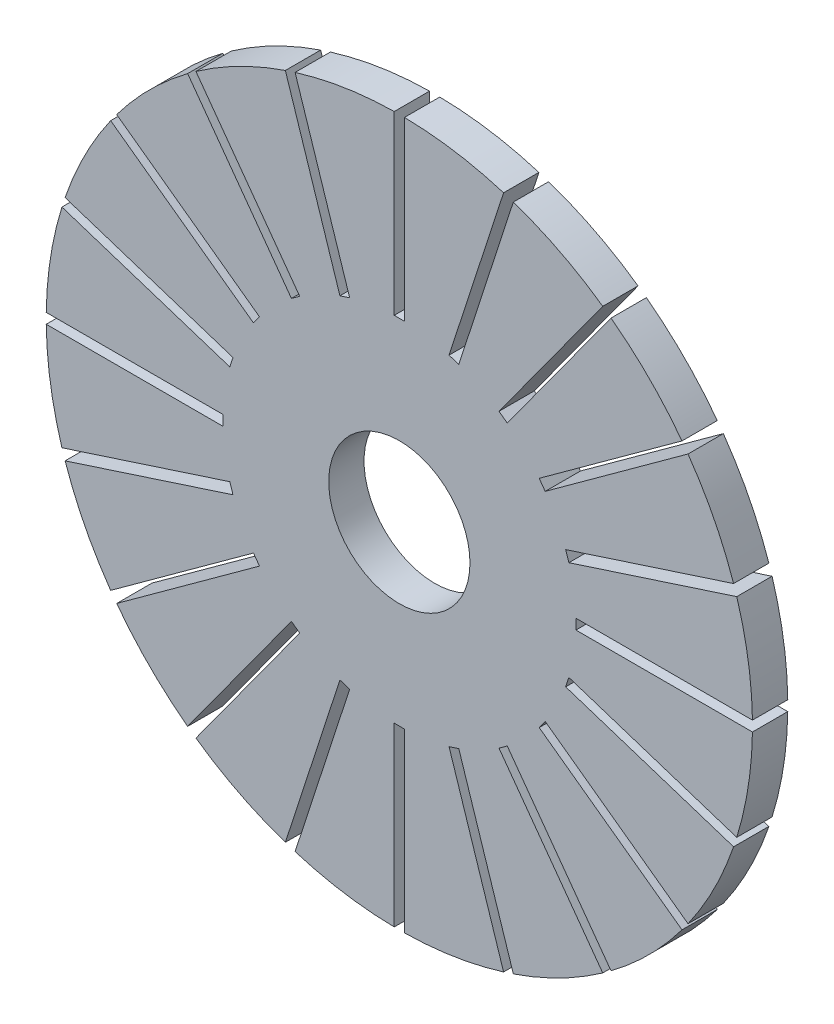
SolidWorks part; units mm, degrees
ref_plane "Front Plane" through (0, 0, 0) normal (0, 0, 1) x (1, 0, 0)
ref_plane "Top Plane" through (0, 0, 0) normal (0, 1, 0) x (1, 0, 0)
ref_plane "Right Plane" through (0, 0, 0) normal (1, 0, 0) x (0, 0, -1)
sketch "Sketch2" plane through (0, 0, 0) normal (0, 0, 1) x (1, 0, 0)
  line L0 (0, 134.1412) -> (0, -136.8693) construction
  line L1 (-158.1514, 0) -> (192.9154, 0) construction
  line L2 (16.8299, 47.1048) -> (14.0718, 48.0009)
  line L3 (1.45, 50) -> (-1.45, 50)
  line L4 (1.45, 50) -> (1.45, 100)
  line L5 (16.8299, 47.1048) -> (32.2807, 94.6576)
  line L6 (-1.45, 50) -> (-1.45, 100)
  line L7 (1.45, 50) -> (-1.45, 100) construction
  line L8 (1.45, 100) -> (-1.45, 50) construction
  line L9 (14.0718, 48.0009) -> (29.5227, 95.5537)
  line L10 (16.8299, 47.1048) -> (29.5227, 95.5537) construction
  line L11 (32.2807, 94.6576) -> (14.0718, 48.0009) construction
  line L12 (30.5623, 39.5986) -> (28.2162, 41.3031)
  line L13 (30.5623, 39.5986) -> (59.9516, 80.0494)
  line L14 (28.2162, 41.3031) -> (57.6055, 81.754)
  line L15 (30.5623, 39.5986) -> (57.6055, 81.754) construction
  line L16 (59.9516, 80.0494) -> (28.2162, 41.3031) construction
  line L17 (41.3031, 28.2162) -> (39.5986, 30.5623)
  line L18 (41.3031, 28.2162) -> (81.754, 57.6055)
  line L19 (39.5986, 30.5623) -> (80.0494, 59.9516)
  line L20 (41.3031, 28.2162) -> (80.0494, 59.9516) construction
  line L21 (81.754, 57.6055) -> (39.5986, 30.5623) construction
  line L22 (48.0009, 14.0718) -> (47.1048, 16.8299)
  line L23 (48.0009, 14.0718) -> (95.5537, 29.5227)
  line L24 (47.1048, 16.8299) -> (94.6576, 32.2807)
  line L25 (48.0009, 14.0718) -> (94.6576, 32.2807) construction
  line L26 (95.5537, 29.5227) -> (47.1048, 16.8299) construction
  line L27 (50, -1.45) -> (50, 1.45)
  line L28 (50, -1.45) -> (100, -1.45)
  line L29 (50, 1.45) -> (100, 1.45)
  line L30 (50, -1.45) -> (100, 1.45) construction
  line L31 (100, -1.45) -> (50, 1.45) construction
  line L32 (47.1048, -16.8299) -> (48.0009, -14.0718)
  line L33 (47.1048, -16.8299) -> (94.6576, -32.2807)
  line L34 (48.0009, -14.0718) -> (95.5537, -29.5227)
  line L35 (47.1048, -16.8299) -> (95.5537, -29.5227) construction
  line L36 (94.6576, -32.2807) -> (48.0009, -14.0718) construction
  line L37 (39.5986, -30.5623) -> (41.3031, -28.2162)
  line L38 (39.5986, -30.5623) -> (80.0494, -59.9516)
  line L39 (41.3031, -28.2162) -> (81.754, -57.6055)
  line L40 (39.5986, -30.5623) -> (81.754, -57.6055) construction
  line L41 (80.0494, -59.9516) -> (41.3031, -28.2162) construction
  line L42 (28.2162, -41.3031) -> (30.5623, -39.5986)
  line L43 (28.2162, -41.3031) -> (57.6055, -81.754)
  line L44 (30.5623, -39.5986) -> (59.9516, -80.0494)
  line L45 (28.2162, -41.3031) -> (59.9516, -80.0494) construction
  line L46 (57.6055, -81.754) -> (30.5623, -39.5986) construction
  line L47 (14.0718, -48.0009) -> (16.8299, -47.1048)
  line L48 (14.0718, -48.0009) -> (29.5227, -95.5537)
  line L49 (16.8299, -47.1048) -> (32.2807, -94.6576)
  line L50 (14.0718, -48.0009) -> (32.2807, -94.6576) construction
  line L51 (29.5227, -95.5537) -> (16.8299, -47.1048) construction
  line L52 (-1.45, -50) -> (1.45, -50)
  line L53 (-1.45, -50) -> (-1.45, -100)
  line L54 (1.45, -50) -> (1.45, -100)
  line L55 (-1.45, -50) -> (1.45, -100) construction
  line L56 (-1.45, -100) -> (1.45, -50) construction
  line L57 (-16.8299, -47.1048) -> (-14.0718, -48.0009)
  line L58 (-16.8299, -47.1048) -> (-32.2807, -94.6576)
  line L59 (-14.0718, -48.0009) -> (-29.5227, -95.5537)
  line L60 (-16.8299, -47.1048) -> (-29.5227, -95.5537) construction
  line L61 (-32.2807, -94.6576) -> (-14.0718, -48.0009) construction
  line L62 (-30.5623, -39.5986) -> (-28.2162, -41.3031)
  line L63 (-30.5623, -39.5986) -> (-59.9516, -80.0494)
  line L64 (-28.2162, -41.3031) -> (-57.6055, -81.754)
  line L65 (-30.5623, -39.5986) -> (-57.6055, -81.754) construction
  line L66 (-59.9516, -80.0494) -> (-28.2162, -41.3031) construction
  line L67 (-41.3031, -28.2162) -> (-39.5986, -30.5623)
  line L68 (-41.3031, -28.2162) -> (-81.754, -57.6055)
  line L69 (-39.5986, -30.5623) -> (-80.0494, -59.9516)
  line L70 (-41.3031, -28.2162) -> (-80.0494, -59.9516) construction
  line L71 (-81.754, -57.6055) -> (-39.5986, -30.5623) construction
  line L72 (-48.0009, -14.0718) -> (-47.1048, -16.8299)
  line L73 (-48.0009, -14.0718) -> (-95.5537, -29.5227)
  line L74 (-47.1048, -16.8299) -> (-94.6576, -32.2807)
  line L75 (-48.0009, -14.0718) -> (-94.6576, -32.2807) construction
  line L76 (-95.5537, -29.5227) -> (-47.1048, -16.8299) construction
  line L77 (-50, 1.45) -> (-50, -1.45)
  line L78 (-50, 1.45) -> (-100, 1.45)
  line L79 (-50, -1.45) -> (-100, -1.45)
  line L80 (-50, 1.45) -> (-100, -1.45) construction
  line L81 (-100, 1.45) -> (-50, -1.45) construction
  line L82 (-47.1048, 16.8299) -> (-48.0009, 14.0718)
  line L83 (-47.1048, 16.8299) -> (-94.6576, 32.2807)
  line L84 (-48.0009, 14.0718) -> (-95.5537, 29.5227)
  line L85 (-47.1048, 16.8299) -> (-95.5537, 29.5227) construction
  line L86 (-94.6576, 32.2807) -> (-48.0009, 14.0718) construction
  line L87 (-39.5986, 30.5623) -> (-41.3031, 28.2162)
  line L88 (-39.5986, 30.5623) -> (-80.0494, 59.9516)
  line L89 (-41.3031, 28.2162) -> (-81.754, 57.6055)
  line L90 (-39.5986, 30.5623) -> (-81.754, 57.6055) construction
  line L91 (-80.0494, 59.9516) -> (-41.3031, 28.2162) construction
  line L92 (-28.2162, 41.3031) -> (-30.5623, 39.5986)
  line L93 (-28.2162, 41.3031) -> (-57.6055, 81.754)
  line L94 (-30.5623, 39.5986) -> (-59.9516, 80.0494)
  line L95 (-28.2162, 41.3031) -> (-59.9516, 80.0494) construction
  line L96 (-57.6055, 81.754) -> (-30.5623, 39.5986) construction
  line L97 (-14.0718, 48.0009) -> (-16.8299, 47.1048)
  line L98 (-14.0718, 48.0009) -> (-29.5227, 95.5537)
  line L99 (-16.8299, 47.1048) -> (-32.2807, 94.6576)
  line L100 (-14.0718, 48.0009) -> (-32.2807, 94.6576) construction
  line L101 (-29.5227, 95.5537) -> (-16.8299, 47.1048) construction
  arc A0 (-1.4494, 99.9895) -> (1.4494, 99.9895) centre (0, 0) ccw
  circle A1 centre (0, 0) radius 20
  point P7 (0, 75)
  point P17 (23.1763, 71.3292)
  point P22 (44.0839, 60.6763)
  point P27 (60.6763, 44.0839)
  point P32 (71.3292, 23.1763)
  point P37 (75, 0)
  point P42 (71.3292, -23.1763)
  point P47 (60.6763, -44.0839)
  point P52 (44.0839, -60.6763)
  point P57 (23.1763, -71.3292)
  point P62 (0, -75)
  point P67 (-23.1763, -71.3292)
  point P72 (-44.0839, -60.6763)
  point P77 (-60.6763, -44.0839)
  point P82 (-71.3292, -23.1763)
  point P87 (-75, 0)
  point P92 (-71.3292, 23.1763)
  point P97 (-60.6763, 44.0839)
  point P102 (-44.0839, 60.6763)
  point P107 (-23.1763, 71.3292)
  point P112 (0, 0)
extrude "Boss-Extrude1" add sketch "Sketch2" along normal blind 10 contours L9 A0 L4 L3 L6 L98 L97 L99 L93 L92 L94 L88 L87 L89 L83 L82 L84 L78 L77 L79 L73 L72 L74 L68 L67 L69 L63 L62 L64 L58 L57 L59 L53 L52 L54 L48 L47 L49 L43
equation "\"D1@Sketch2\"=200mm"
equation "\"D2@Sketch2\"=50"
equation "\"D3@Sketch2\"=2.9"
equation "\"D4@Sketch2\"=50"
equation "\"D5@Sketch2\"=40"
